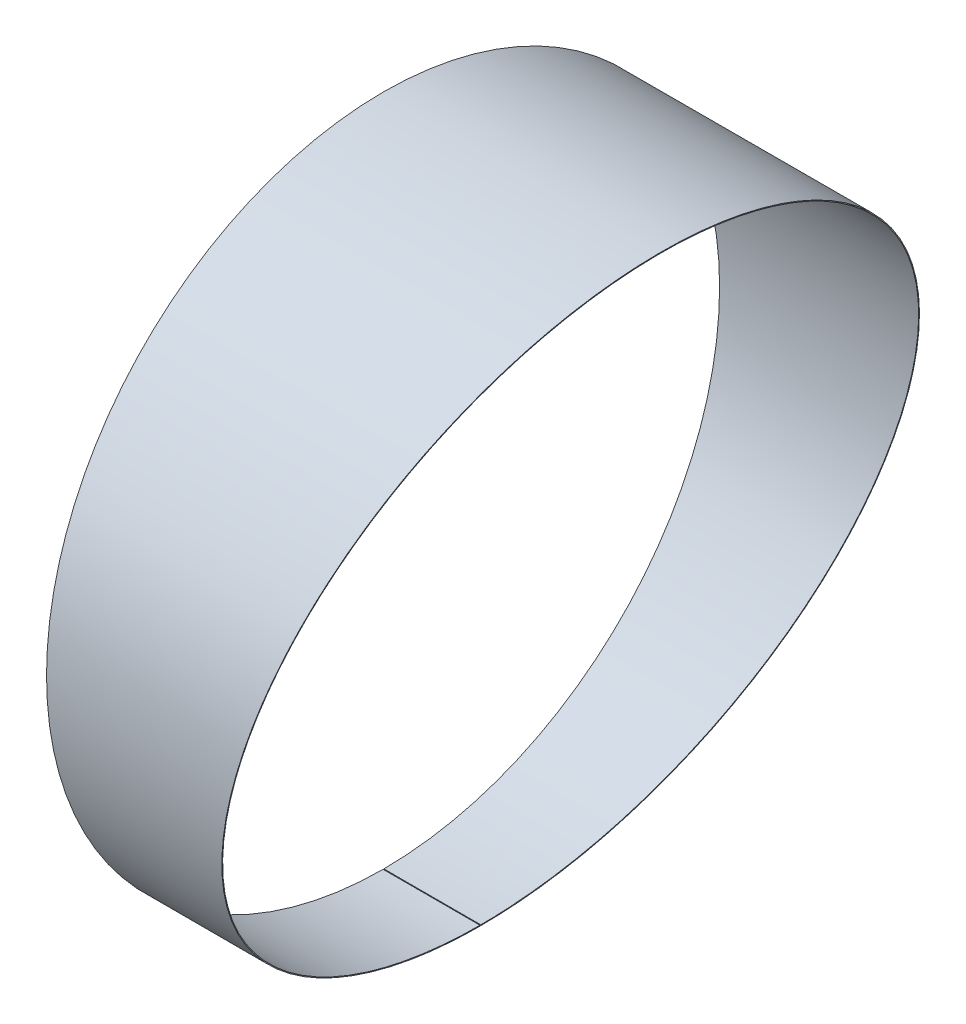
SolidWorks part; units mm, degrees
ref_plane "前视基准面" through (0, 0, 0) normal (0, 0, 1) x (1, 0, 0)
ref_plane "上视基准面" through (0, 0, 0) normal (0, 1, 0) x (1, 0, 0)
ref_plane "右视基准面" through (0, 0, 0) normal (1, 0, 0) x (0, 0, -1)
imported_body "基体零件-等径四节弯头-1"
sheet metal parameters "钣金1" parameters "D1"=0.7366, "厚度"=1
bend "圆角折弯1" bend radius 409 bend angle 359.86 parameters "D5"=1
flatten bends "展开-折弯1" parameters "D1"=0
sketch "尖角-草图1" plane through (58.9489, 440.0003, -0.5) normal (0, -1, -0.0012) x (1, 0, 0)
  line L0 (58.9489, -1284.4126) -> (-58.9489, -1284.4126) construction
process bends "加工-折弯1" parameters "D1"=0
sketch "平面-草图1" plane through (58.9489, 440.0003, -0.5) normal (0, -1, -0.0012) x (1, 0, 0)
